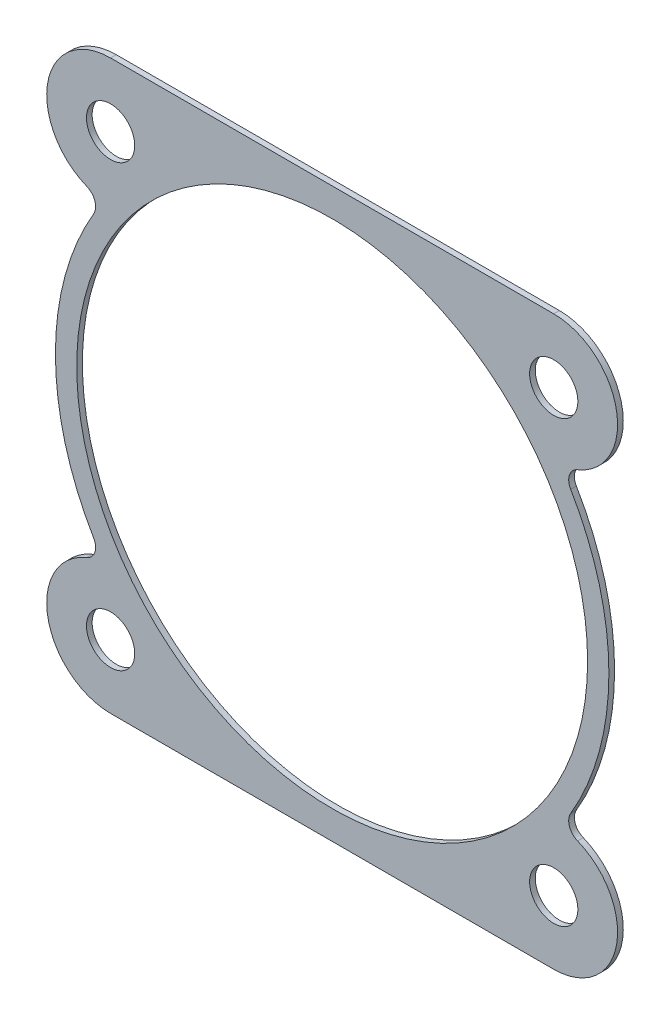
SolidWorks part; units mm, degrees
ref_plane "Plan1" through (0, 0, 0) normal (0, 0, 1) x (1, 0, 0)
ref_plane "Plan2" through (0, 0, 0) normal (0, 1, 0) x (1, 0, 0)
ref_plane "Plan3" through (0, 0, 0) normal (1, 0, 0) x (0, 0, -1)
sketch "Esquisse1" plane through (0, 0, 0) normal (0, 0, 1) x (1, 0, 0)
  line L0 (0, 24.7958) -> (0, -28.468) construction
  line L1 (15.6125, 20) -> (-15.6125, 20)
  line L2 (-15.6125, -20) -> (15.6125, -20)
  arc A0 (-16.8053, -9.891) -> (-16.8053, 9.891) centre (0, 0) cw
  arc A1 (17.2936, 11.3258) -> (15.6125, 20) centre (15.6125, 15.5) ccw
  arc A2 (-16.8053, -9.891) -> (-17.2936, -11.3258) centre (-17.6671, -10.3982) cw
  arc A3 (17.2936, 11.3258) -> (16.8053, 9.891) centre (17.6671, 10.3982) ccw
  arc A4 (-15.6125, -20) -> (-17.2936, -11.3258) centre (-15.6125, -15.5) cw
  arc A5 (-17.2936, 11.3258) -> (-16.8053, 9.891) centre (-17.6671, 10.3982) cw
  arc A6 (-17.2936, 11.3258) -> (-15.6125, 20) centre (-15.6125, 15.5) cw
  arc A7 (15.6125, -20) -> (17.2936, -11.3258) centre (15.6125, -15.5) ccw
  arc A8 (16.8053, -9.891) -> (17.2936, -11.3258) centre (17.6671, -10.3982) ccw
  arc A9 (16.8053, -9.891) -> (16.8053, 9.891) centre (0, 0) ccw
  point P27 (0, 20)
  dimension "D1" = 4.5
  dimension "D2" = 19.5
  dimension "D3" = 4.5
  dimension "D4" = 1
  dimension "D5" = 1
  dimension "D14" = 15.5
  dimension "D15" = 15.6125
  dimension "D6" = 20
  dimension "D8" = 15.6125
  dimension "D9" = 15.5
  dimension "D10" = 17.6671
  dimension "D11" = 10.3982
  dimension "D12" = 17.6671
  dimension "D13" = 10.3982
extrude "Base-Extrusion" add sketch "Esquisse1" along normal mid plane 0.4
hole_wizard "Perçage1" positions "Esquisse3" profile "Esquisse2" hole size "M3" standard "ISO"
sketch "Esquisse3" plane through (0, 0, 0.2) normal (0, 0, 1) x (1, 0, 0)
  arc A0 (17.2936, 11.3258) -> (15.6125, 20) centre (15.6125, 15.5) ccw construction
  arc A2 (-15.6125, 20) -> (-17.2936, 11.3258) centre (-15.6125, 15.5) ccw construction
  arc A3 (-17.2936, -11.3258) -> (-15.6125, -20) centre (-15.6125, -15.5) ccw construction
  arc A4 (15.6125, -20) -> (17.2936, -11.3258) centre (15.6125, -15.5) ccw construction
  point P0 (15.6125, 15.5)
  point P1 (-15.6125, 15.5)
  point P3 (-15.6125, -15.5)
  point P4 (15.6125, -15.5)
sketch "Esquisse2" plane through (15.6125, 15.5, 0.2) normal (1, 0, 0) x (0, -1, 0)
  line L0 (0, 0) -> (0, 0.4)
  line L1 (0, 0.4) -> (1.7, 0.4)
  line L2 (1.7, 0.4) -> (1.7, 0)
  line L5 (1.7, 0) -> (0, 0)
  line L11 (0, -6.35) -> (0, 107.95) construction
  dimension "Diamètre du perçage jusqu'au prochain" = 3.4
  dimension "Profondeur du perçage jusqu'au prochain" = 0.4
sketch "Esquisse4" plane through (0, 0, 0.2) normal (0, 0, 1) x (1, 0, 0)
  circle A0 centre (0, 0) radius 18
  dimension "D1" = 36
extrude "Enlèv. mat.-Extru.1" cut sketch "Esquisse4" against normal through all
